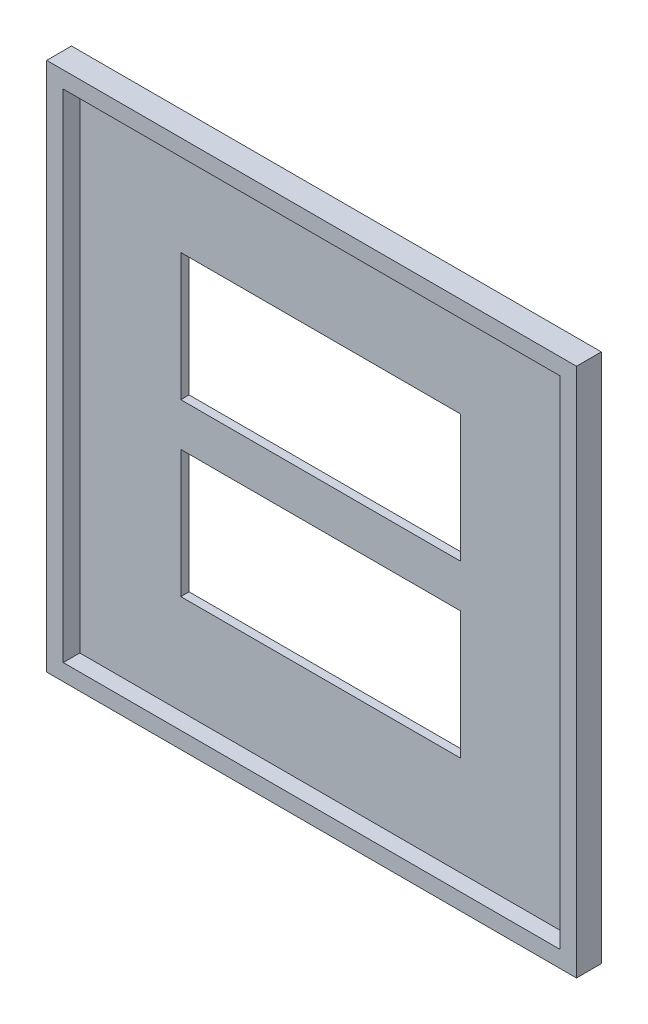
SolidWorks part; units mm, degrees
ref_plane "Front Plane" through (0, 0, 0) normal (0, 0, 1) x (1, 0, 0)
ref_plane "Top Plane" through (0, 0, 0) normal (0, 1, 0) x (1, 0, 0)
ref_plane "Right Plane" through (0, 0, 0) normal (1, 0, 0) x (0, 0, -1)
sketch "Sketch1" plane through (0, 0, 0) normal (0, 0, 1) x (1, 0, 0)
  line L1 (-40.64, -40.64) -> (40.64, -40.64)
  line L2 (-40.64, -40.64) -> (-40.64, 40.64)
  line L3 (-40.64, 40.64) -> (40.64, 40.64)
  line L4 (40.64, -40.64) -> (40.64, 40.64)
  line L5 (-40.64, -40.64) -> (40.64, 40.64) construction
  line L6 (-40.64, 40.64) -> (40.64, -40.64) construction
  point P0 (0, 0)
  dimension "D1" = 81.28
  dimension "D2" = 81.28
extrude "Boss-Extrude1" add sketch "Sketch1" along normal blind 3.81
sketch "Sketch2" plane through (0, 0, 3.81) normal (0, 0, 1) x (1, 0, 0)
  line L1 (-38.1, -38.1) -> (38.1, -38.1)
  line L2 (-38.1, -38.1) -> (-38.1, 38.1)
  line L3 (-38.1, 38.1) -> (38.1, 38.1)
  line L4 (38.1, -38.1) -> (38.1, 38.1)
  line L5 (-38.1, -38.1) -> (38.1, 38.1) construction
  line L6 (-38.1, 38.1) -> (38.1, -38.1) construction
  point P0 (0, 0)
  dimension "D1" = 76.2
  dimension "D2" = 76.2
extrude "Cut-Extrude1" cut sketch "Sketch2" against normal blind 2.54
sketch "Sketch3" plane through (0, 0, 0) normal (0, 0, -1) x (-1, 0, 0)
  line L0 (40.64, -40.64) -> (-40.64, -40.64) construction
  line L1 (-20.32, 22.86) -> (22.606, 22.86)
  line L2 (-20.32, 22.86) -> (-20.32, 3.302)
  line L3 (-20.32, 3.302) -> (22.606, 3.302)
  line L4 (22.606, 22.86) -> (22.606, 3.302)
  line L5 (-20.32, 22.86) -> (22.606, 3.302) construction
  line L6 (-20.32, 3.302) -> (22.606, 22.86) construction
  line L7 (-20.32, -3.302) -> (22.606, -3.302)
  line L8 (-20.32, -3.302) -> (-20.32, -22.86)
  line L9 (-20.32, -22.86) -> (22.606, -22.86)
  line L10 (22.606, -3.302) -> (22.606, -22.86)
  line L11 (-20.32, -3.302) -> (22.606, -22.86) construction
  line L12 (-20.32, -22.86) -> (22.606, -3.302) construction
  line L13 (-40.64, 40.64) -> (40.64, 40.64) construction
  line L14 (-40.64, -40.64) -> (-40.64, 40.64) construction
  point P0 (1.143, 13.081)
  point P5 (1.143, -13.081)
  dimension "D1" = 42.926
  dimension "D2" = 19.558
  dimension "D3" = 19.558
  dimension "D4" = 42.926
  dimension "D5" = 17.78
  dimension "D6" = 17.78
  dimension "D7" = 20.32
  dimension "D8" = 20.32
extrude "Cut-Extrude2" cut sketch "Sketch3" against normal through all
